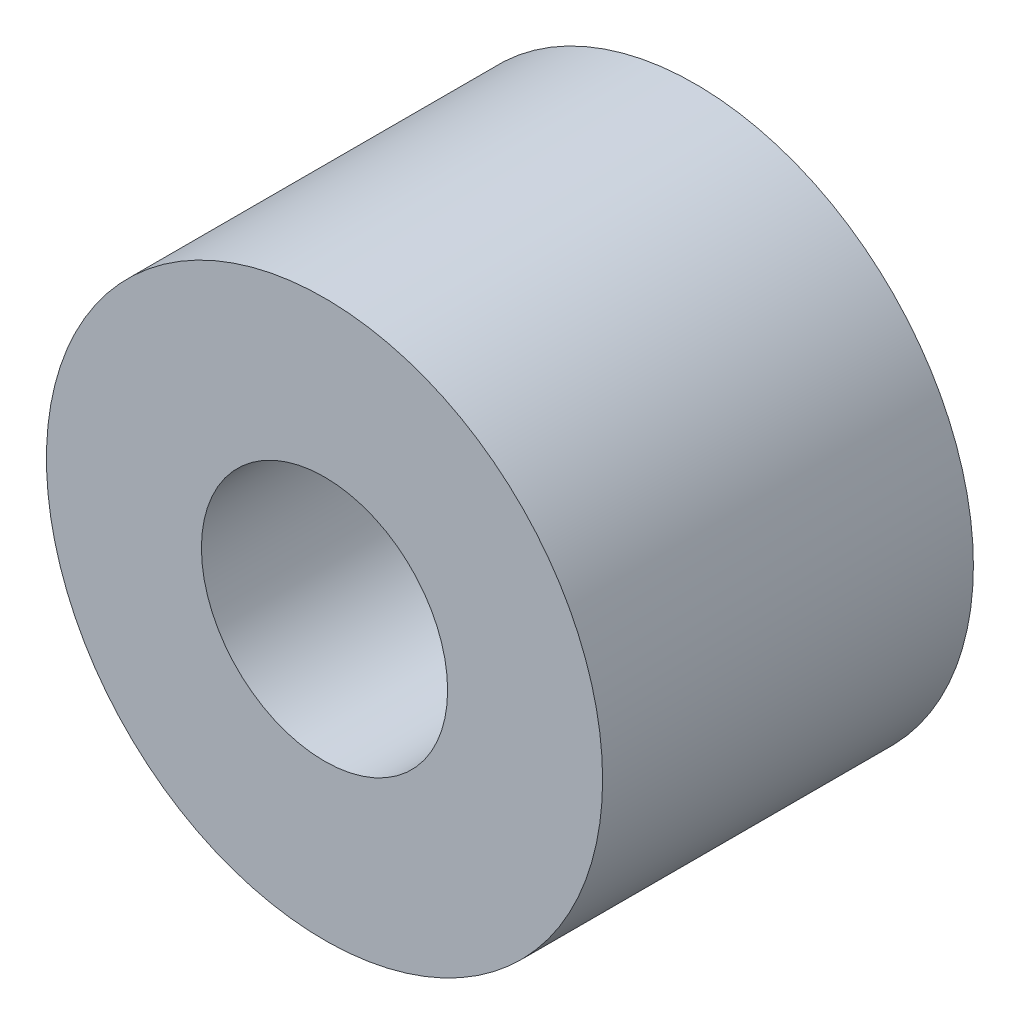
SolidWorks part; units mm, degrees
ref_plane "Front Plane" through (0, 0, 0) normal (0, 0, 1) x (1, 0, 0)
ref_plane "Top Plane" through (0, 0, 0) normal (0, 1, 0) x (1, 0, 0)
ref_plane "Right Plane" through (0, 0, 0) normal (1, 0, 0) x (0, 0, -1)
sketch "Sketch1" plane through (0, 0, 0) normal (0, 0, 1) x (1, 0, 0)
  line L0 (0, 2.1082) -> (0, 4.7625) construction
  line L1 (0, -2.1082) -> (0, -4.7625) construction
  circle A0 centre (0, 0) radius 4.7625
  circle A1 centre (0, 0) radius 2.1082
  dimension "OD" = 9.525
  dimension "ID" = 4.2164
sketch "Sketch2" plane through (0, 0, 0) normal (1, 0, 0) x (0, 0, -1)
  line L0 (-3.175, 2.1082) -> (3.175, 2.1082) construction
  line L1 (-3.175, -2.1082) -> (3.175, -2.1082) construction
  line L2 (-3.175, -4.7625) -> (3.175, -4.7625) construction
  line L3 (-3.175, 4.7625) -> (3.175, 4.7625) construction
  dimension "Length" = 6.35
extrude "Extrude1" add sketch "Sketch1" along normal up to vertex (3.175 mm away) and the other way up to vertex (3.175 mm away)
sketch "Sketch3" plane through (0, 0, 3.175) normal (0, 0, 1) x (1, 0, 0)
  circle A0 centre (0, 0) radius 2.1082 construction
  circle A3 centre (0, 0) radius 2.1082
  point P3 (-2.1082, 0)
